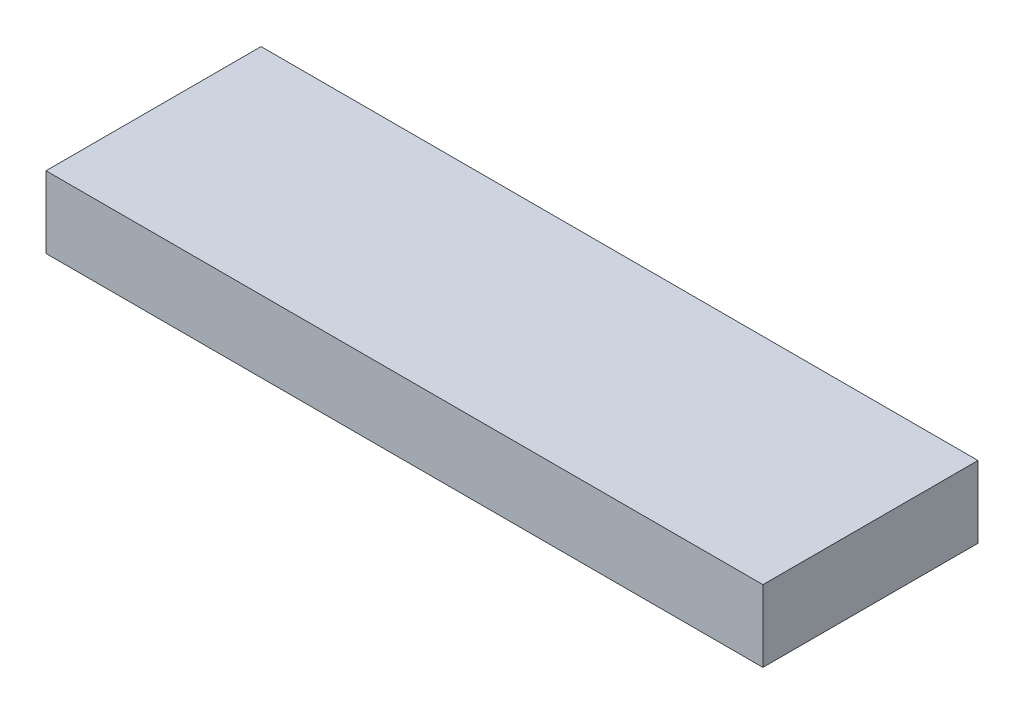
SolidWorks part; units mm, degrees
ref_plane "Front Plane" through (0, 0, 0) normal (0, 0, 1) x (1, 0, 0)
ref_plane "Top Plane" through (0, 0, 0) normal (0, 1, 0) x (1, 0, 0)
ref_plane "Right Plane" through (0, 0, 0) normal (1, 0, 0) x (0, 0, -1)
sketch "Sketch1" plane through (0, 0, 0) normal (0, 1, 0) x (1, 0, 0)
  line L1 (0, 0) -> (100, 0)
  line L2 (0, 0) -> (0, 30)
  line L3 (0, 30) -> (100, 30)
  line L4 (100, 0) -> (100, 30)
  dimension "D1" = 100
  dimension "D2" = 30
extrude "Boss-Extrude1" add sketch "Sketch1" along normal blind 10
